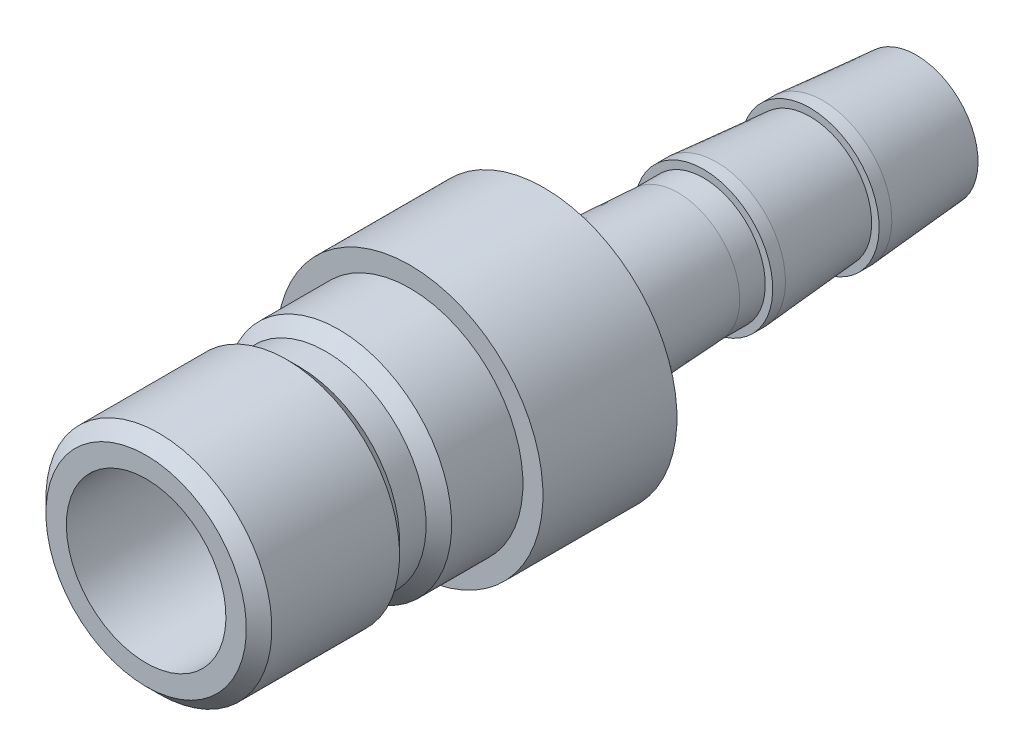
SolidWorks part; units mm, degrees
ref_plane "Front Plane" through (0, 0, 0) normal (0, 0, 1) x (1, 0, 0)
ref_plane "Top Plane" through (0, 0, 0) normal (0, 1, 0) x (1, 0, 0)
ref_plane "Right Plane" through (0, 0, 0) normal (1, 0, 0) x (0, 0, -1)
sketch "Sketch1" plane through (0, 0, 0) normal (1, 0, 0) x (0, 0, -1)
  line L0 (0, 0) -> (-18.923, 0) construction
  line L1 (-15.748, 4.7625) -> (-15.748, 5.9817)
  line L2 (-6.604, 5.9817) -> (-6.604, 0) construction
  line L3 (-14.986, 6.7437) -> (-7.366, 6.7437)
  line L4 (0, 7.9375) -> (0, 0) construction
  line L5 (-6.604, 5.9817) -> (-5.0165, 5.9817)
  line L6 (-4.2545, 6.7437) -> (0, 6.7437)
  line L7 (0, 6.7437) -> (0, 7.9375)
  line L8 (-6.604, 5.9817) -> (-7.366, 6.7437)
  line L9 (-5.0165, 5.9817) -> (-4.2545, 6.7437)
  line L10 (-15.748, 5.9817) -> (-14.986, 6.7437)
  line L11 (-15.748, 4.7625) -> (-3.556, 4.7625)
  line L12 (0, 7.9375) -> (8.001, 7.9375)
  line L13 (24.638, 4.1275) -> (23.876, 4.1275)
  line L14 (30.226, 3.683) -> (30.226, 3.175)
  line L15 (0, 0) -> (4.445, 0) construction
  line L16 (23.876, 4.1275) -> (23.876, 3.683)
  line L17 (-0.6919, 3.175) -> (30.226, 3.175)
  line L18 (-3.556, 4.7625) -> (-0.6919, 3.175)
  line L19 (30.226, 3.683) -> (24.638, 4.1275)
  line L20 (18.288, 4.1275) -> (17.526, 4.1275)
  line L21 (23.876, 3.683) -> (18.288, 4.1275)
  line L23 (17.526, 3.683) -> (16.002, 3.683)
  line L24 (16.002, 3.683) -> (8.001, 4.1275)
  line L25 (8.001, 4.1275) -> (8.001, 7.9375)
  line L26 (17.526, 4.1275) -> (17.526, 3.683)
  point P4 (17.526, 2.8442)
  point P14 (0, 0)
  dimension "D1" = 15.748
  dimension "D2" = 1.5875
  dimension "D3" = 0.762
  dimension "D4" = 45
  dimension "D5" = 9.144
  dimension "D6" = 45
  dimension "D7" = 15.875
  dimension "D8" = 22.225
  dimension "D9" = 45.974
  dimension "D10" = 6.35
  dimension "D11" = 9.525
  dimension "D12" = 0.762
  dimension "D13" = 8.255
  dimension "D14" = 13.4874
  dimension "D15" = 6.35
  dimension "D16" = 12.192
  dimension "D17" = 7.366
  dimension "D18" = 1.524
revolve "Revolve1" add sketch "Sketch1" angle 360 about L0
